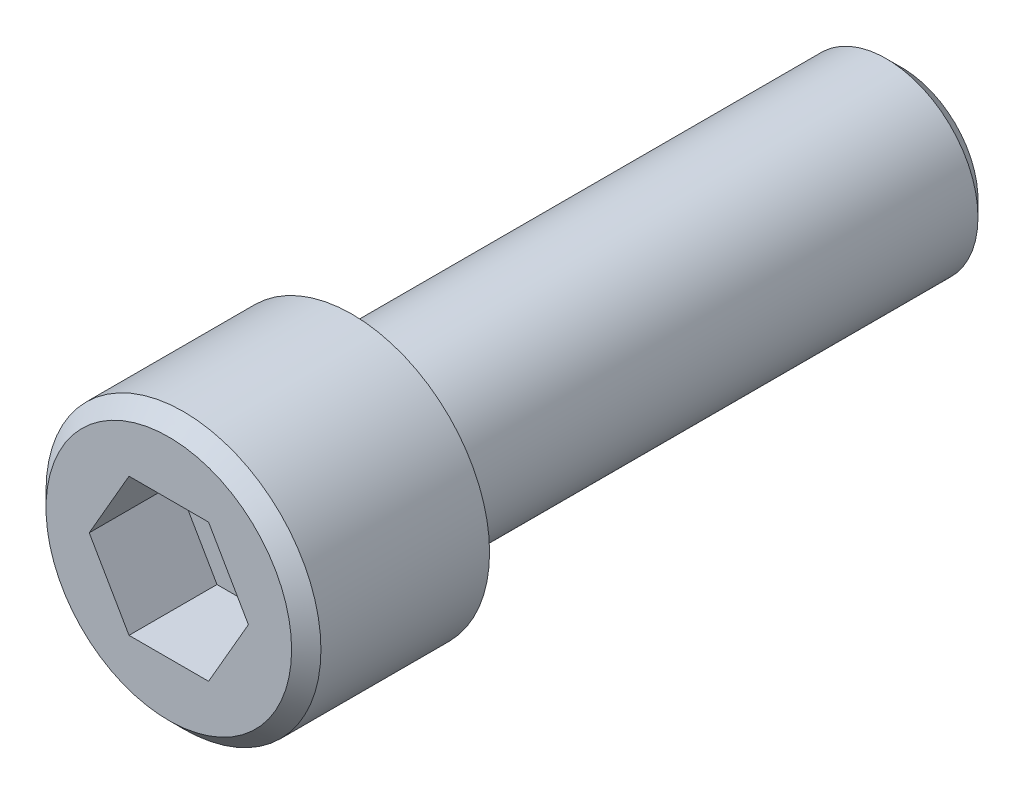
SolidWorks part; units mm, degrees
ref_plane "Front Plane" through (0, 0, 0) normal (0, 0, 1) x (1, 0, 0)
ref_plane "Top Plane" through (0, 0, 0) normal (0, 1, 0) x (1, 0, 0)
ref_plane "Right Plane" through (0, 0, 0) normal (1, 0, 0) x (0, 0, -1)
sketch "Sketch1" plane through (0, 0, 0) normal (0, 0, 1) x (1, 0, 0)
  circle A0 centre (0, 0) radius 4.7625
  dimension "D1" = 9.525
extrude "Boss-Extrude1" add sketch "Sketch1" along normal blind 6.35
chamfer "Chamfer1" distance 0.508 angle 45 1 edges at (4.7625, 0, 6.35)
sketch "Sketch2" plane through (0, 0, 6.35) normal (0, 0, 1) x (1, 0, 0)
  line L1 (-2.757, 0) -> (-1.3785, -2.3876)
  line L2 (-1.3785, -2.3876) -> (1.3785, -2.3876)
  line L3 (1.3785, -2.3876) -> (2.757, 0)
  line L4 (2.757, 0) -> (1.3785, 2.3876)
  line L5 (1.3785, 2.3876) -> (-1.3785, 2.3876)
  line L6 (-1.3785, 2.3876) -> (-2.757, 0)
  circle A0 centre (0, 0) radius 2.3876 construction
  dimension "D1" = 4.7752
extrude "Cut-Extrude1" cut sketch "Sketch2" against normal blind 3.048
sketch "Sketch4" plane through (0, 0, 0) normal (0, 0, -1) x (-1, 0, 0)
  circle A0 centre (0, 0) radius 3.175
  dimension "D1" = 6.35
extrude "Boss-Extrude2" add sketch "Sketch4" along normal blind 19.05
sketch "Sketch5" plane through (0, 0, -19.05) normal (0, 0, -1) x (-1, 0, 0)
  circle A0 centre (0, 0) radius 2.6337
extrude "Cut-Extrude3" cut sketch "Sketch5" against normal blind 19.05 draft 45 flip side to cut
